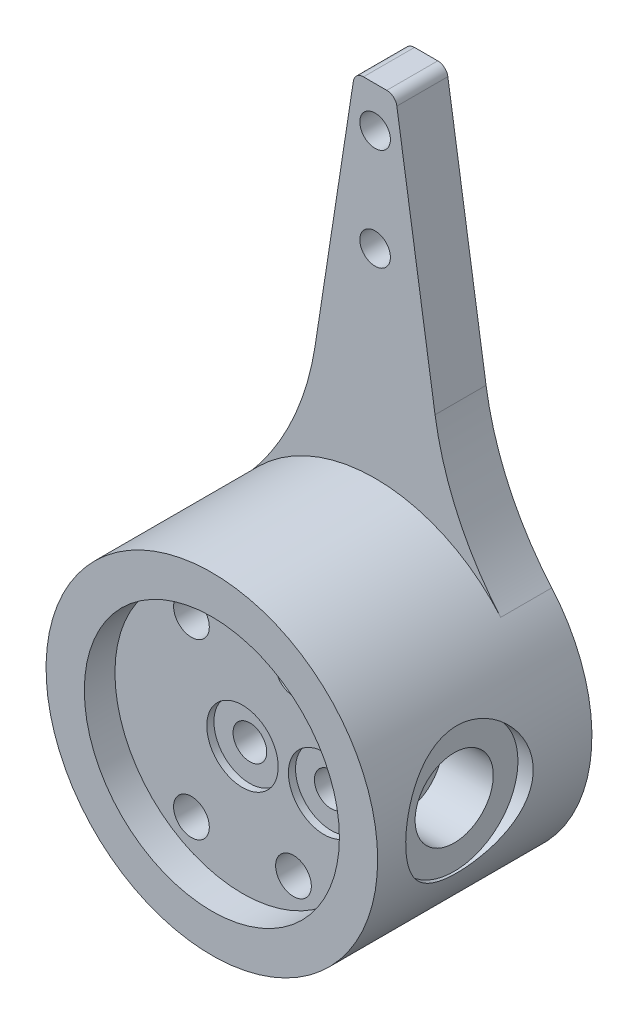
SolidWorks part; units mm, degrees
ref_plane "Plan de face" through (0, 0, 0) normal (0, 0, 1) x (1, 0, 0)
ref_plane "Plan de dessus" through (0, 0, 0) normal (0, 1, 0) x (1, 0, 0)
ref_plane "Plan de droite" through (0, 0, 0) normal (1, 0, 0) x (0, 0, -1)
sketch "Esquisse1" plane through (0, 0, 0) normal (0, 0, 1) x (1, 0, 0)
  line L0 (0, 116.1874) -> (0, -34.973) construction
  line L1 (-11.7493, 49.1492) -> (-4, 99.5)
  line L2 (-4, 99.5) -> (4, 99.5)
  line L3 (11.7493, 49.1492) -> (4, 99.5)
  arc A0 (-24.6259, 21.2089) -> (24.6259, 21.2089) centre (0, 0) ccw
  arc A1 (-24.6259, 21.2089) -> (-11.7493, 49.1492) centre (-66.9285, 57.6417) ccw
  circle A2 centre (0, 91.5) radius 3
  circle A3 centre (0, 71.5) radius 3
  arc A4 (24.6259, 21.2089) -> (11.7493, 49.1492) centre (66.9285, 57.6417) cw
  point P17 (0, 99.5)
  dimension "D1" = 65
  dimension "D3" = 6
  dimension "D5" = 6
  dimension "D2" = 8
  dimension "D4" = 8
  dimension "D6" = 20
  dimension "D7" = 99.5
extrude "Extrusion1" add sketch "Esquisse1" along normal blind 10
fillet "Congé1" radius 2 2 edges at (-4, 99.5, 5) (4, 99.5, 5)
sketch "Esquisse2" plane through (0, 0, 10) normal (0, 0, 1) x (1, 0, 0)
  line L0 (-10, 44.1289) -> (-10, -42.4454) construction
  line L1 (-49.8131, 17) -> (57.8476, 17) construction
  line L2 (-49.8131, -17) -> (50.3045, -17) construction
  line L3 (0, 66.7583) -> (0, -43.9883) construction
  circle A1 centre (0, 0) radius 32.5
  circle A2 centre (-10, 17) radius 3.5
  circle A3 centre (-10, -17) radius 3.5
  circle A4 centre (10, -17) radius 3.5
  circle A5 centre (10, 17) radius 3.5
  dimension "D4" = 7
  dimension "D5" = 7
  dimension "D1" = 10
  dimension "D2" = 17
  dimension "D3" = 17
extrude "Extrusion2" add sketch "Esquisse2" along normal blind 32
sketch "Esquisse4" plane through (0, 0, 0) normal (0, 0, -1) x (-1, 0, 0)
  circle A0 centre (-10, 17) radius 5.5
  circle A1 centre (10, 17) radius 5.5
  circle A2 centre (-10, -17) radius 5.5
  circle A3 centre (10, -17) radius 5.5
  dimension "D1" = 11
  dimension "D2" = 11
  dimension "D3" = 11
  dimension "D4" = 11
extrude "Extrusion4" cut sketch "Esquisse4" against normal blind 11
sketch "Esquisse5" plane through (0, 0, 42) normal (0, 0, 1) x (1, 0, 0)
  circle A0 centre (0, 0) radius 25
  dimension "D1" = 50
extrude "Extrusion5" cut sketch "Esquisse5" against normal blind 6
sketch "Esquisse6" plane through (0, 0, 36) normal (0, 0, 1) x (1, 0, 0)
  circle A0 centre (0, 0) radius 7
  circle A1 centre (16, 0) radius 7
  dimension "D1" = 14
  dimension "D2" = 14
  dimension "D3" = 16
extrude "Extrusion6" cut sketch "Esquisse6" against normal blind 1.4
sketch "Esquisse7" plane through (0, 0, 34.6) normal (0, 0, 1) x (1, 0, 0)
  point P0 (16, 0)
  point P1 (0, 0)
hole_wizard "Dégagement M61" positions "Esquisse3D1" profile "Esquisse8" hole size "M6" standard "ISO"
sketch3d "Esquisse3D1"
  point P0 (16, 0, 34.6)
  point P6 (0.0547, 0, 34.6)
sketch "Esquisse8" plane through (16, 0, 34.6) normal (1, 0, 0) x (0, -1, 0)
  line L0 (0, 0) -> (0, 18.9828)
  line L1 (0, 18.9828) -> (3.3, 17)
  line L2 (3.3, 17) -> (3.3, 0)
  line L5 (3.3, 0) -> (0, 0)
  line L10 (0, 18.9828) -> (-3.3, 17) construction
  line L11 (0, -6.35) -> (0, 107.95) construction
  dimension "Diamètre du perçage" = 6.6
  dimension "Profondeur du perçage" = 17
  dimension "Angle de pointe" = 118
ref_plane "Plan1" through (32.5, 0, 21) normal (1, 0, 0) x (0, -1, 0)
sketch "Esquisse9" plane through (32.5, 0, 21) normal (1, 0, 0) x (0, -1, 0)
  line L0 (0, 21) -> (0, -28.2326) construction
  line L1 (-32.5, -21) -> (32.5, -21) construction
  circle A0 centre (0, -3) radius 12.5
  dimension "D1" = 25
  dimension "D2" = 18
extrude "Extrusion7" cut sketch "Esquisse9" against normal blind 3
sketch "Esquisse10" plane through (29.5, 0, 0) normal (1, 0, 0) x (0, 0, -1)
  circle A0 centre (-24, 0) radius 7.6625
  dimension "D1" = 15.325
extrude "Extrusion8" cut sketch "Esquisse10" against normal blind 10
sketch "Esquisse11" plane through (19.5, 0, 0) normal (1, 0, 0) x (0, 0, -1)
  circle A0 centre (-24, 0) radius 3.5
  dimension "D1" = 7
extrude "Extrusion9" cut sketch "Esquisse11" against normal blind 3
ref_plane "Plan2" through (-32.5, 0, 0) normal (1, 0, 0) x (0, 0, -1)
sketch "Esquisse12" plane through (-32.5, 0, 0) normal (1, 0, 0) x (0, 0, -1)
  line L0 (0, 0) -> (-53.6719, 0) construction
  line L1 (-42, 32.5) -> (-42, -32.5) construction
  circle A0 centre (-24, 0) radius 12.5
  dimension "D1" = 25
  dimension "D2" = 18
extrude "Extrusion11" cut sketch "Esquisse12" along normal blind 3
sketch "Esquisse13" plane through (-29.5, 0, 0) normal (-1, 0, 0) x (0, 0, 1)
  circle A0 centre (24, 0) radius 7.6625
  dimension "D1" = 15.325
extrude "Extrusion12" cut sketch "Esquisse13" against normal blind 11
sketch "Esquisse14" plane through (-18.5, 0, 0) normal (-1, 0, 0) x (0, 0, 1)
  circle A0 centre (24, 0) radius 3.5
  dimension "D1" = 7
extrude "Extrusion13" cut sketch "Esquisse14" against normal blind 17.5
